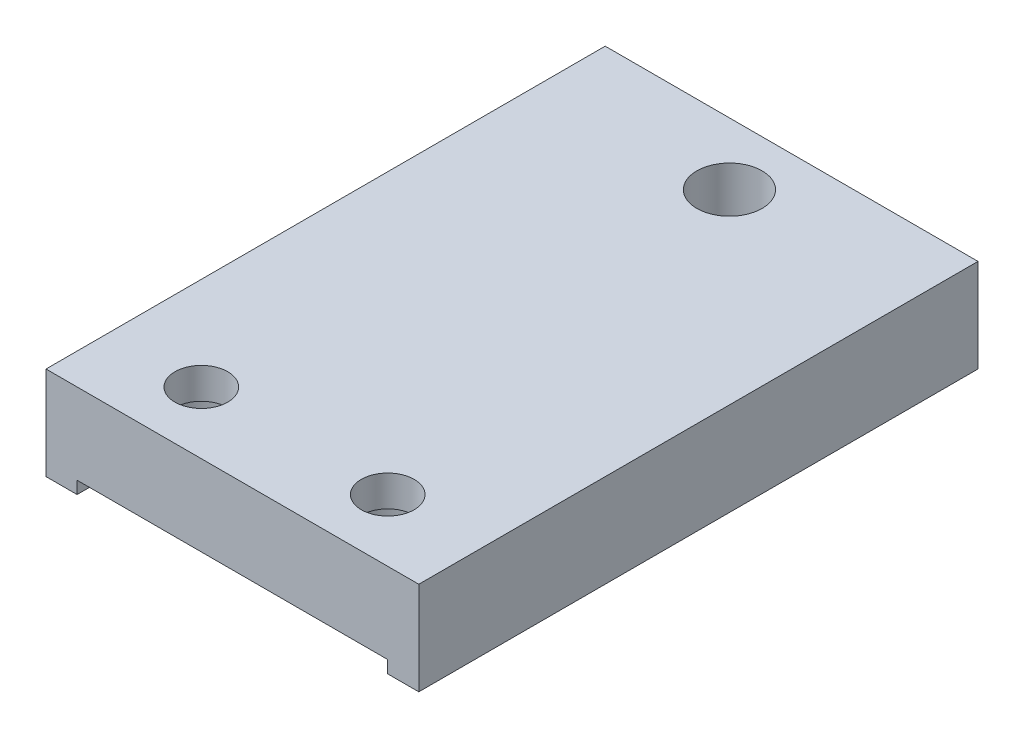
SolidWorks part; units mm, degrees
ref_plane "Plan de face" through (0, 0, 0) normal (0, 0, 1) x (1, 0, 0)
ref_plane "Plan de dessus" through (0, 0, 0) normal (0, 1, 0) x (1, 0, 0)
ref_plane "Plan de droite" through (0, 0, 0) normal (1, 0, 0) x (0, 0, -1)
sketch "Esquisse1" plane through (0, 0, 0) normal (0, 0, 1) x (1, 0, 0)
  line L1 (0, 0) -> (60, 0)
  line L2 (0, 0) -> (0, 15)
  line L3 (0, 15) -> (60, 15)
  line L4 (60, 0) -> (60, 15)
  dimension "D1" = 60
  dimension "D2" = 15
extrude "Extrusion1" add sketch "Esquisse1" along normal blind 90
sketch "Esquisse2" plane through (0, 0, 90) normal (0, 0, 1) x (1, 0, 0)
  line L0 (0, 0) -> (60, 0) construction
  line L1 (5, 0) -> (55, 0)
  line L2 (5, 0) -> (5, 2)
  line L3 (5, 2) -> (55, 2)
  line L4 (55, 0) -> (55, 2)
  line L5 (0, 15) -> (0, 0) construction
  dimension "D1" = 50
  dimension "D2" = 2
  dimension "D3" = 5
extrude "Enlèv. mat.-Extru.1" cut sketch "Esquisse2" against normal through all
hole_wizard "Chambrage pour axes 8.5 mm1" positions "Esquisse4" profile "Esquisse3" counterbore size "8.5" standard "HASCO Métrique"
sketch "Esquisse4" plane through (-40.1289, 2, 38.3871) normal (0, 1, 0) x (-1, 0, 0)
  line L0 (-100.1289, 51.6129) -> (-40.1289, 51.6129) construction
  line L3 (-40.1289, 51.6129) -> (-40.1289, -38.3871) construction
  point P0 (-55.1289, 41.6129)
  point P5 (-85.1289, 41.6129)
  dimension "D1" = 30
  dimension "D3" = 10
  dimension "D4" = 15
sketch "Esquisse3" plane through (15, 2, 80) normal (1, 0, 0) x (0, 0, -1)
  line L0 (0, 0) -> (0, 13)
  line L1 (0, 13) -> (4.25, 13)
  line L3 (4.25, 13) -> (4.25, 8)
  line L4 (4.25, 8) -> (7.5, 8)
  line L5 (7.5, 8) -> (7.5, 0)
  line L7 (7.5, 0) -> (0, 0)
  line L11 (0, -6.35) -> (0, 107.95) construction
  dimension "Diamètre du perçage jusqu'au prochain" = 8.5
  dimension "Profondeur du perçage jusqu'au prochain" = 13
  dimension "Diamètre du chambrage" = 15
  dimension "Profondeur du chambrage" = 8
hole_wizard "Diamètre du perçage Ø10.5 (10,5                                                                                                                                                                         " positions "Esquisse6" profile "Esquisse5" hole size "Ø10.5" standard "ISO"
sketch "Esquisse6" plane through (0, 15, 0) normal (0, 1, 0) x (-1, 0, 0)
  line L0 (0, 90) -> (0, 0) construction
  line L1 (-60, 0) -> (0, 0) construction
  point P0 (-30, 10)
  dimension "D1" = 30
  dimension "D2" = 10
sketch "Esquisse5" plane through (30, 15, 10) normal (1, 0, 0) x (0, 0, 1)
  line L0 (0, 0) -> (0, 15)
  line L1 (0, 15) -> (5.25, 15)
  line L2 (5.25, 15) -> (5.25, 0)
  line L5 (5.25, 0) -> (0, 0)
  line L11 (0, -6.35) -> (0, 107.95) construction
  dimension "Diamètre du perçage jusqu'au prochain" = 10.5
  dimension "Profondeur du perçage jusqu'au prochain" = 15
